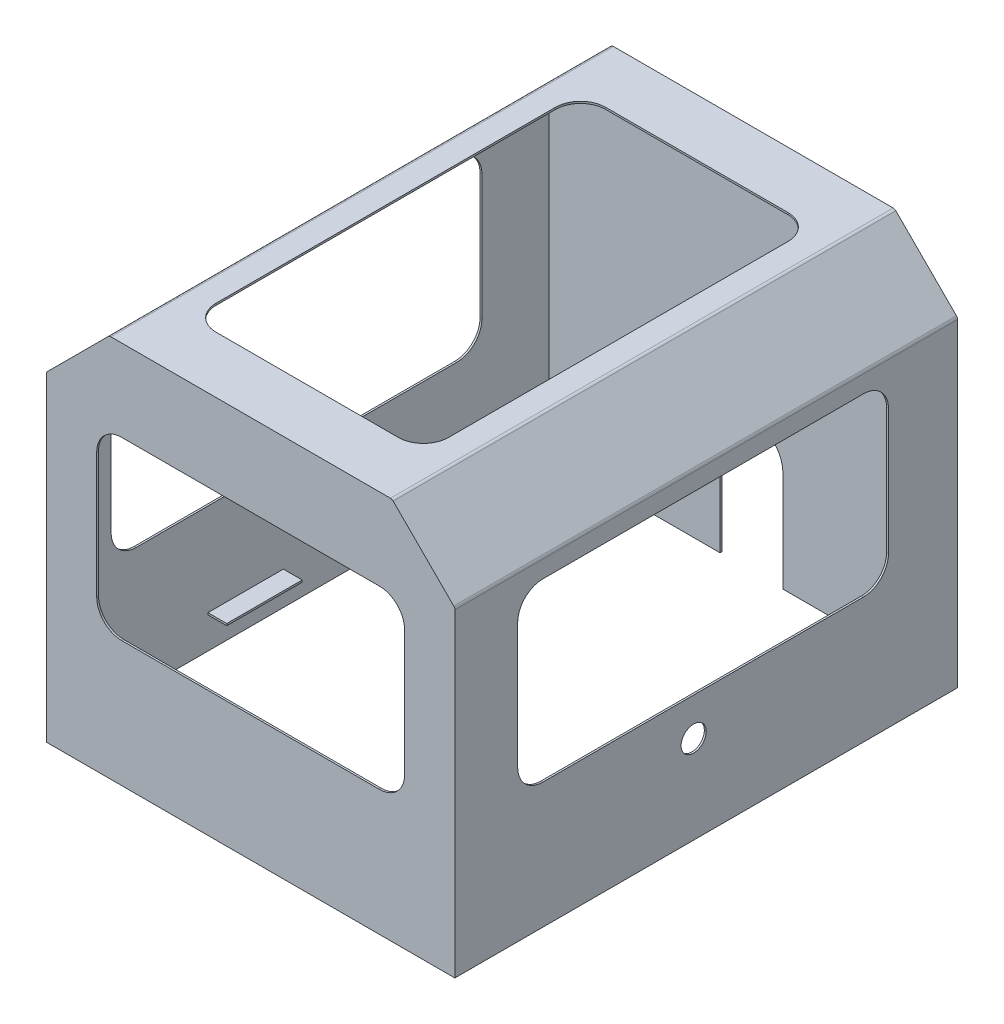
SolidWorks part; units mm, degrees
ref_plane "Plan1" through (0, 0, 0) normal (0, 0, 1) x (1, 0, 0)
ref_plane "Plan2" through (0, 0, 0) normal (0, 1, 0) x (1, 0, 0)
ref_plane "Plan3" through (0, 0, 0) normal (1, 0, 0) x (0, 0, -1)
sketch "Esquisse1" plane through (0, 0, 0) normal (0, 1, 0) x (1, 0, 0)
  line L1 (0, 0) -> (325, 0)
  line L2 (0, 0) -> (0, 400)
  line L3 (0, 400) -> (325, 400)
  line L4 (325, 0) -> (325, 400)
extrude "Base-Extrusion" add sketch "Esquisse1" along normal blind 305
chamfer "Chanfrein1" distance 50 distance2 50
fillet "Congé1" radius 3
shell "Coque1" thickness 1.5
sketch "Esquisse2" plane through (0, 305, 0) normal (0, 1, 0) x (-1, 0, 0)
  line L1 (-235, -45) -> (-90, -45)
  line L2 (-255, -65) -> (-255, -335)
  line L3 (-235, -355) -> (-90, -355)
  line L4 (-70, -65) -> (-70, -335)
  arc A0 (-235, -45) -> (-255, -65) centre (-235, -65) ccw
  arc A1 (-90, -45) -> (-70, -65) centre (-90, -65) cw
  arc A2 (-70, -335) -> (-90, -355) centre (-90, -335) cw
  arc A4 (-235, -355) -> (-255, -335) centre (-235, -335) cw
  point P12 (0, 0)
  dimension "D1" = 20
  dimension "D2" = 20
  dimension "D4" = 20
extrude "Enlèv. mat.-Extru.1" cut sketch "Esquisse2" against normal blind 1.5
sketch "Esquisse3" plane through (0, 0, 0) normal (0, 0, 1) x (1, 0, 0)
  line L1 (60, 240) -> (265, 240)
  line L2 (40, 220) -> (40, 120)
  line L3 (265, 100) -> (60, 100)
  line L4 (285, 220) -> (285, 120)
  arc A0 (285, 220) -> (265, 240) centre (265, 220) ccw
  arc A1 (265, 100) -> (285, 120) centre (265, 120) ccw
  arc A2 (40, 120) -> (60, 100) centre (60, 120) ccw
  arc A3 (60, 240) -> (40, 220) centre (60, 220) ccw
  dimension "D1" = 20
extrude "Enlèv. mat.-Extru.2" cut sketch "Esquisse3" against normal blind 1.5
sketch "Esquisse4" plane through (325, 0, 0) normal (1, 0, 0) x (0, 0, -1)
  line L1 (70, 240) -> (325, 240)
  line L2 (50, 220) -> (50, 120)
  line L3 (70, 100) -> (325, 100)
  line L4 (345, 220) -> (345, 120)
  arc A0 (70, 240) -> (50, 220) centre (70, 220) ccw
  arc A1 (345, 220) -> (325, 240) centre (325, 220) ccw
  arc A2 (325, 100) -> (345, 120) centre (325, 120) ccw
  arc A3 (50, 120) -> (70, 100) centre (70, 120) ccw
  dimension "D1" = 20
extrude "Enlèv. mat.-Extru.3" cut sketch "Esquisse4" against normal through all
sketch "Esquisse5" plane through (1.5, 0, 0) normal (1, 0, 0) x (0, 0, -1)
  line L0 (127, 26.5) -> (187, 26.5)
  line L1 (232, 26.5) -> (292, 26.5)
  line L2 (232, 26.5) -> (232, 25)
  line L3 (232, 25) -> (292, 25)
  line L4 (292, 26.5) -> (292, 25)
  line L5 (127, 26.5) -> (127, 25)
  line L6 (127, 25) -> (187, 25)
  line L7 (187, 26.5) -> (187, 25)
extrude "Boss.-Extru.1" add sketch "Esquisse5" along normal blind 15
sketch "Esquisse6" plane through (323.5, 0, 0) normal (-1, 0, 0) x (0, 0, 1)
  line L0 (-232, 25) -> (-292, 25)
  line L5 (-232, 25) -> (-232, 26.5)
  line L6 (-232, 26.5) -> (-292, 26.5)
  line L7 (-292, 25) -> (-292, 26.5)
  line L8 (-127, 25) -> (-186.9707, 25)
  line L9 (-127, 25) -> (-127.0293, 26.5)
  line L10 (-127.0293, 26.5) -> (-187, 26.5)
  line L11 (-186.9707, 25) -> (-187, 26.5)
extrude "Boss.-Extru.2" add sketch "Esquisse6" along normal blind 15
sketch "Esquisse7" plane through (0, 0, -400) normal (0, 0, -1) x (-1, 0, 0)
  line L0 (-325, 0) -> (0, 0) construction
  line L1 (-137.5, 0) -> (-187.5, 0)
  line L3 (-187.5, 10) -> (-187.5, 0)
  line L4 (-187.5, 80) -> (-187.5, 10)
  line L5 (-137.5, 10) -> (-137.5, 0)
  line L6 (-137.5, 80) -> (-137.5, 10)
  arc A1 (-187.5, 80) -> (-137.5, 80) centre (-162.5, 80) cw
extrude "Enlèv. mat.-Extru.4" cut sketch "Esquisse7" against normal blind 1.5
sketch "Esquisse8" plane through (0, 0, 0) normal (-1, 0, 0) x (0, 0, 1)
  circle A0 centre (-190, 70) radius 10
extrude "Enlèv. mat.-Extru.5" cut sketch "Esquisse8" against normal through all
